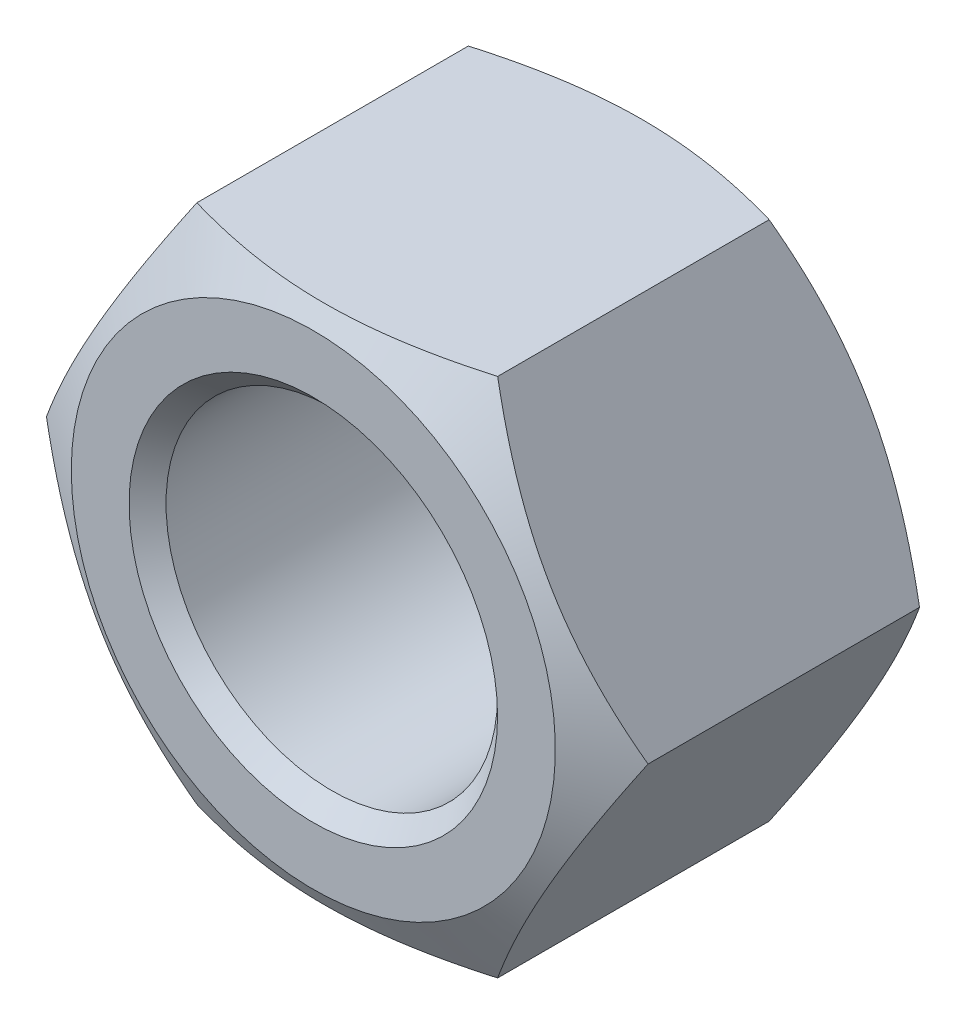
SolidWorks part; units mm, degrees
ref_plane "Front" through (0, 0, 0) normal (0, 0, 1) x (1, 0, 0)
ref_plane "Top" through (0, 0, 0) normal (0, 1, 0) x (1, 0, 0)
ref_plane "Right" through (0, 0, 0) normal (1, 0, 0) x (0, 0, -1)
sketch "Sketch1" plane through (0, 0, 0) normal (0, 0, 1) x (1, 0, 0)
  line L1 (15.8771, -27.5) -> (31.7543, 0)
  line L2 (31.7543, 0) -> (15.8771, 27.5)
  line L3 (15.8771, 27.5) -> (-15.8771, 27.5)
  line L4 (-15.8771, 27.5) -> (-31.7543, 0)
  line L5 (-31.7543, 0) -> (-15.8771, -27.5)
  line L6 (-15.8771, -27.5) -> (15.8771, -27.5)
  circle A0 centre (0, 0) radius 27.5 construction
  circle A1 centre (0, 0) radius 17.5
  dimension "D1" = 35
  dimension "s" = 55
extrude "BaseNut" add sketch "Sketch1" against normal blind 34.7
sketch "Sketch2" plane through (15.0481, 0, -16.7061) normal (0, 1, 0) x (0, 0, -1)
  line L0 (-23.7227, 15.0481) -> (22.0646, 15.0481) construction
  line L2 (17.9939, 46.8024) -> (17.9939, 30.9252) construction
  line L4 (17.9939, 46.8024) -> (-16.7061, 46.8024) construction
  line L8 (15.5376, 46.8024) -> (17.9939, 42.5481)
  line L9 (17.9939, 46.8024) -> (15.5376, 46.8024)
  line L10 (17.9939, 42.5481) -> (17.9939, 46.8024)
  dimension "D1" = 30
  dimension "s1" = 55
revolve "Chamfer1" cut sketch "Sketch2" angle 360 about L0
sketch "Sketch6" plane through (-9.1975, 0, -10.2525) normal (0, 1, 0) x (0, 0, 1)
  line L0 (23.3574, 9.1975) -> (-22.3023, 9.1975) construction
  line L2 (-24.4475, 26.6975) -> (-24.4475, 28.6475)
  line L4 (-24.4475, 28.6475) -> (-23.3216, 26.6975)
  line L6 (-23.3216, 26.6975) -> (-24.4475, 26.6975)
  dimension "da" = 38.9
  dimension "D2" = 60
revolve "EndChamfer1" cut sketch "Sketch6" angle 360 about L0
sketch "Sketch5" plane through (-14.793, 0, -16.9612) normal (0, 1, 0) x (0, 0, 1)
  line L0 (-22.5748, 14.793) -> (24.743, 14.793) construction
  line L2 (16.9612, 40.343) -> (16.9612, 46.5473)
  line L4 (16.9612, 46.5473) -> (13.3792, 46.5473)
  line L6 (13.3792, 46.5473) -> (16.9612, 40.343)
  dimension "dw1" = 51.1
  dimension "D2" = 30
revolve "Chamfer2" cut sketch "Sketch5" angle 360 about L0
sketch "Sketch3" plane through (-20.9491, 1.8856, 0) normal (0, 0, 1) x (1, 0, 0)
  circle A1 centre (20.9491, -1.8856) radius 17.5 construction
  circle A2 centre (20.9491, -1.8856) radius 25.55
  circle A3 centre (20.9491, -1.8856) radius 17.5
  dimension "dw" = 51.1
extrude "Extrude1" [suppressed] add sketch "Sketch3" along normal blind 0.8
chamfer "EndChamfer3" [suppressed] distance 1.1567 angle 45
chamfer "EndChamfer2" distance 1.95 angle 45 1 edges at (17.5, 0, 0)
sketch "Sketch7" plane through (0, 0, 0) normal (0, 1, 0) x (1, 0, 0)
  line L0 (0, 48.6183) -> (0, -13.0076) construction
  line L1 (16.5, 34.0742) -> (17.5, 34.0742)
  line L2 (17.5, 34.0742) -> (18.366, 33.5742)
  line L3 (18.366, 33.5742) -> (17.5, 33.0742)
  line L4 (17.5, 33.0742) -> (16.5, 33.0742)
  line L5 (16.5, 33.0742) -> (16.5, 34.0742)
  line L6 (17.5, 33.5742) -> (-17.5, 33.5742) construction
  dimension "D1" = 1
  dimension "D2" = 35
revolve "Cut-Revolve10" [suppressed] cut sketch "Sketch7" angle 360 about L0
pattern_linear "LPattern10" [suppressed] count 28 spacing 1.2 along (0, 0, -1)
equation "\"D1@EndChamfer3\" = \"m@BaseNut\" / 30"
equation "\"s1@Sketch2\" = \"s@Sketch1\""
equation "\"D2@Sketch7\" = \"D1@Sketch1\""
equation "\"D1@Sketch7\" = (  \"D2@ThreadCosmetic1\" - \"D1@Sketch1\" )  / 2"
equation "\"D3@LPattern10\" = \"D1@Sketch7\" * 1.2"
equation "\"D1@LPattern10\" = \"m@BaseNut\" / \"D3@LPattern10\" - 1"
equation "\"D1@EndChamfer2\" = (  \"da@Sketch6\" - \"D1@Sketch1\" )  / 2"
